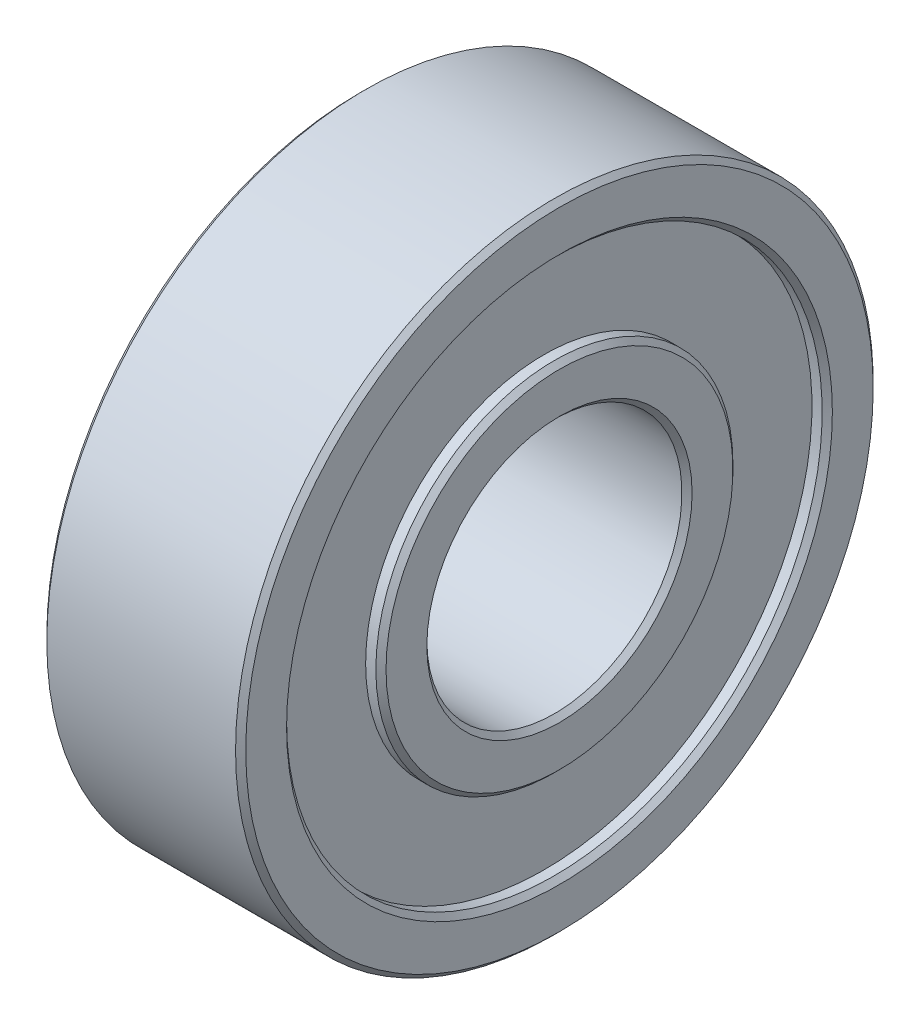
SolidWorks part; units mm, degrees
ref_plane "Front Plane" through (0, 0, 0) normal (0, 0, 1) x (1, 0, 0)
ref_plane "Top Plane" through (0, 0, 0) normal (0, 1, 0) x (1, 0, 0)
ref_plane "Right Plane" through (0, 0, 0) normal (1, 0, 0) x (0, 0, -1)
sketch "Sketch1" plane through (0, 0, 0) normal (0, 1, 0) x (1, 0, 0)
  line L0 (-29.0787, 0) -> (50.7304, 0) construction
  line L1 (0.127, 3.175) -> (4.826, 3.175)
  line L2 (4.953, 3.302) -> (4.953, 4.318)
  line L3 (4.826, 4.445) -> (4.572, 4.445)
  line L4 (4.572, 4.445) -> (4.572, 6.6675)
  line L5 (4.572, 6.6675) -> (4.826, 6.6675)
  line L6 (4.953, 6.7945) -> (4.953, 7.8105)
  line L7 (4.826, 7.9375) -> (0.127, 7.9375)
  line L8 (0, 7.8105) -> (0, 6.7945)
  line L9 (0.127, 6.6675) -> (0.381, 6.6675)
  line L10 (0.381, 6.6675) -> (0.381, 4.445)
  line L11 (0.381, 4.445) -> (0.127, 4.445)
  line L12 (0, 4.318) -> (0, 3.302)
  line L13 (0.127, 7.9375) -> (0, 7.8105)
  line L14 (4.953, 7.8105) -> (4.826, 7.9375)
  line L15 (4.826, 3.175) -> (4.953, 3.302)
  line L16 (0, 3.302) -> (0.127, 3.175)
  line L17 (0.127, 4.445) -> (0, 4.318)
  line L18 (0, 6.7945) -> (0.127, 6.6675)
  line L19 (4.826, 6.6675) -> (4.953, 6.7945)
  line L20 (4.953, 4.318) -> (4.826, 4.445)
  point P3 (0, 3.175)
  point P4 (4.953, 3.175)
  point P6 (4.953, 4.445)
  point P9 (4.953, 6.6675)
  point P10 (4.953, 7.9375)
  point P11 (0, 7.9375)
  point P12 (0, 6.6675)
  point P15 (0, 4.445)
  dimension "D1" = 4.953
  dimension "D2" = 3.175
  dimension "D3" = 1.27
  dimension "D4" = 1.27
  dimension "D5" = 7.9375
  dimension "D6" = 0.381
revolve "Revolve1" add sketch "Sketch1" angle 360 about L0
